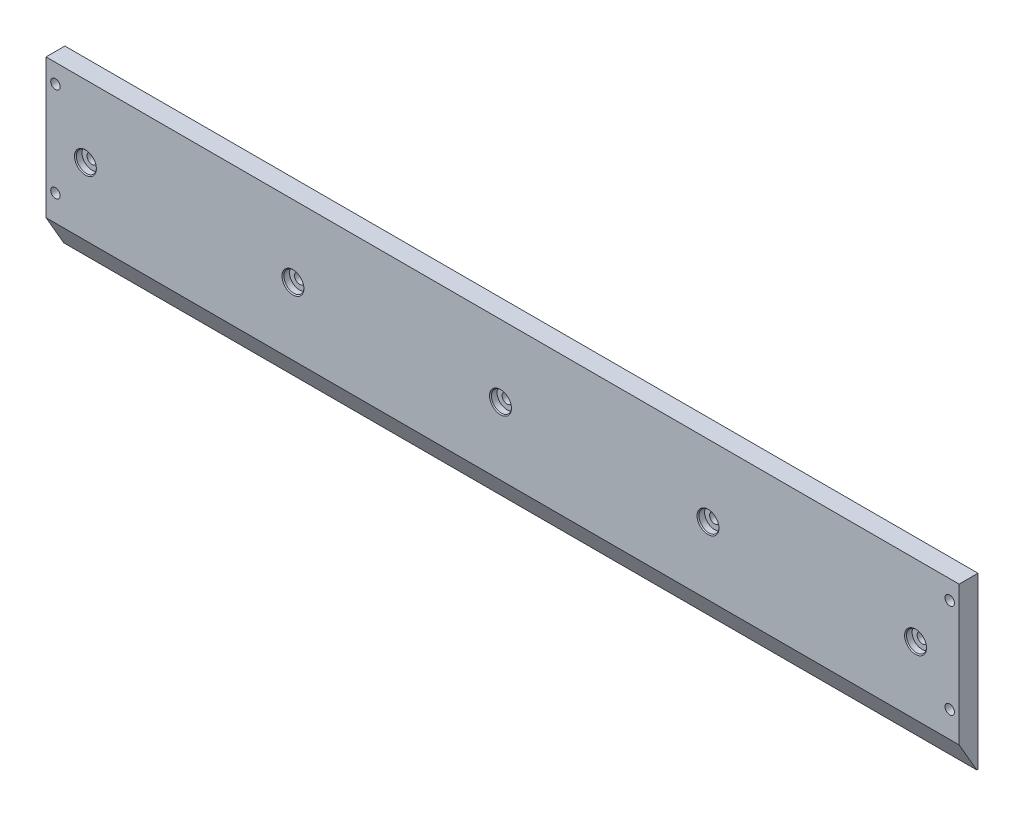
SolidWorks part; units mm, degrees
ref_plane "Front Plane" through (0, 0, 0) normal (0, 0, 1) x (1, 0, 0)
ref_plane "Top Plane" through (0, 0, 0) normal (0, 1, 0) x (1, 0, 0)
ref_plane "Right Plane" through (0, 0, 0) normal (1, 0, 0) x (0, 0, -1)
sketch "Sketch1" plane through (0, 0, 0) normal (1, 0, 0) x (0, 0, -1)
  line L0 (-734.7746, 0) -> (36003.956, 0) construction
  line L1 (0, -734.7746) -> (0, 36003.956) construction
  line L2 (0, 0) -> (-0.8216, 0)
  line L3 (-12.7, 20.574) -> (-12.7, 114.3)
  line L4 (-12.7, 114.3) -> (0, 114.3)
  line L5 (0, 114.3) -> (0, 0)
  line L6 (-0.8216, 0) -> (-12.7, 20.574)
  dimension "D1" = 12.7
  dimension "D2" = 114.3
  dimension "D3" = 30
  dimension "D4" = 20.574
extrude "Boss-Extrude1" add sketch "Sketch1" along normal mid plane 614.68
sketch "Sketch2" plane through (0, 0, 12.7) normal (0, 0, 1) x (1, 0, 0)
  line L0 (0, -1000) -> (0, 49000) construction
  line L1 (-1000, 0) -> (49000, 0) construction
  line L2 (307.34, 114.3) -> (-307.34, 114.3) construction
  line L3 (-307.34, 114.3) -> (-307.34, 20.574) construction
  circle A0 centre (-300.99, 101.6) radius 3.175
  circle A1 centre (-300.99, 38.1) radius 3.175
  circle A2 centre (300.99, 38.1) radius 3.175
  circle A3 centre (300.99, 101.6) radius 3.175
  dimension "D4" = 6.35
  dimension "D1" = 12.7
  dimension "D2" = 63.5
  dimension "D3" = 6.35
extrude "Cut-Extrude1" cut sketch "Sketch2" against normal blind 87.63
sketch "Sketch3" plane through (0, 0, 12.7) normal (0, 0, 1) x (1, 0, 0)
  line L0 (0, -1000) -> (0, 49000) construction
  line L1 (307.34, 0) -> (-307.34, 0) construction
  line L2 (-1000, 0) -> (49000, 0) construction
  line L5 (307.34, 114.3) -> (-307.34, 114.3) construction
  line L6 (-307.34, 114.3) -> (-307.34, 20.574) construction
  point P5 (0, 0)
  point P11 (-280.797, 66.04)
  dimension "D1" = 48.26
  dimension "D2" = 26.543
hole_wizard "CBORE for 1/4 Pan Head Machine Screw1" positions "Sketch4" profile "Sketch5" counterbore size "1/4" standard "ANSI Inch"
sketch "Sketch4" plane through (0, 0, 12.7) normal (0, 0, 1) x (1, 0, 0)
  point P0 (-280.797, 66.04)
sketch "Sketch5" plane through (-280.797, 66.04, 12.7) normal (1, 0, 0) x (0, -1, 0)
  line L0 (0, 0) -> (0, 12.7)
  line L1 (0, 12.7) -> (3.3782, 12.7)
  line L3 (3.3782, 12.7) -> (3.3782, 4.445)
  line L4 (6.7462, 4.445) -> (3.3782, 4.445)
  line L5 (6.7462, 4.445) -> (6.7462, 0.635)
  line L6 (6.7462, 0.635) -> (7.3812, 0)
  line L7 (7.3812, 0) -> (0, 0)
  line L8 (-6.7462, 0.635) -> (-7.3812, 0) construction
  line L11 (0, -6.35) -> (0, 107.95) construction
  dimension "Thru Hole Dia." = 6.7564
  dimension "Thru Hole Depth" = 12.7
  dimension "C'Bore Dia." = 13.4925
  dimension "C'Bore Depth" = 4.445
  dimension "Near C'Sink Dia." = 14.7625
  dimension "Near C'Sink Angle" = 90
pattern_linear "LPattern1" count 5 spacing 139.7 along (1, 0, 0) of "CBORE for 1/4 Pan Head Machine Screw1"
